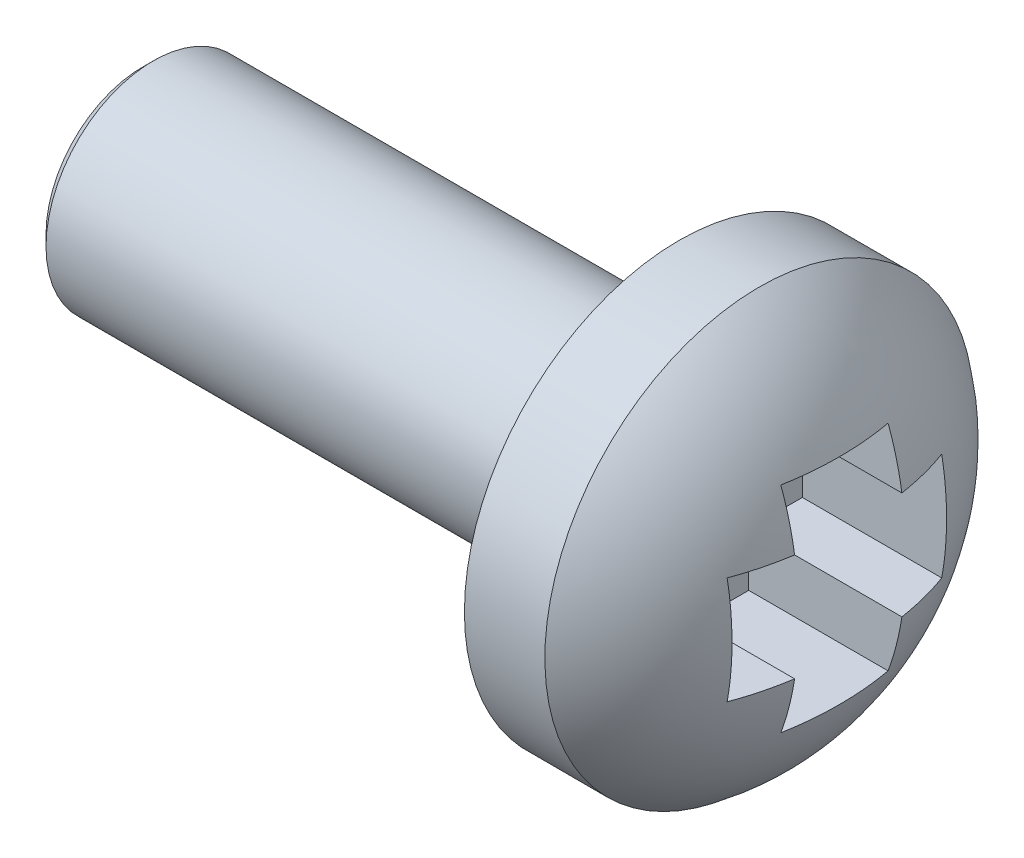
SolidWorks part; units mm, degrees
ref_plane "Plan de face" through (0, 0, 0) normal (0, 0, 1) x (1, 0, 0)
ref_plane "Plan de dessus" through (0, 0, 0) normal (0, 1, 0) x (1, 0, 0)
ref_plane "Plan de droite" through (0, 0, 0) normal (1, 0, 0) x (0, 0, -1)
sketch "Esquisse1" plane through (0, 0, 0) normal (0, 0, 1) x (1, 0, 0)
  line L0 (11.0618, 0) -> (-32.4908, 0) construction
  line L1 (-0.3, 2) -> (-0.3, 4)
  line L2 (-0.3, 4) -> (1.2, 4)
  line L3 (-0.3, 2) -> (-10.3, 2)
  line L4 (-10.3, 2) -> (-10.3, 0)
  line L5 (3, -1.2574) -> (3, 1.2574) construction
  line L6 (3, 0) -> (-10.3, 0)
  spline S0 degree 2 poles (1.2, 4) (3, 2.6918) (3, 0) knots 0 0 0 1 1 1
  dimension "D1" = 2
  dimension "D2" = 10
  dimension "D3" = 4
  dimension "D4" = 1.5
  dimension "D5" = 3
revolve "Révolution1" add sketch "Esquisse1" angle 360 about L0
chamfer "Chanfrein1" distance 0.2 angle 45 1 edges at (-10.3, 0, -2)
sketch "Esquisse2" plane through (-0.3, 0, 0) normal (-1, 0, 0) x (0, 0, 1)
  line L0 (-1, 1) -> (-2, 1)
  line L1 (1, 2) -> (-1, 2)
  line L2 (1, 2) -> (1, 1)
  line L3 (1, -2) -> (-1, -2)
  line L4 (-1, 2) -> (-1, 1)
  line L5 (2, 1) -> (1, 1)
  line L6 (2, 1) -> (2, -1)
  line L7 (2, -1) -> (1, -1)
  line L8 (-2, 1) -> (-2, -1)
  line L9 (1, -1) -> (1, -2)
  line L10 (-1, -1) -> (-2, -1)
  line L11 (-1, -1) -> (-1, -2)
  dimension "D1" = 2
  dimension "D2" = 4
  dimension "D3" = 2
  dimension "D4" = 2
extrude "Enlèv. mat.-Extru.1" cut sketch "Esquisse2" along normal blind 3.2 from offset 3.5
